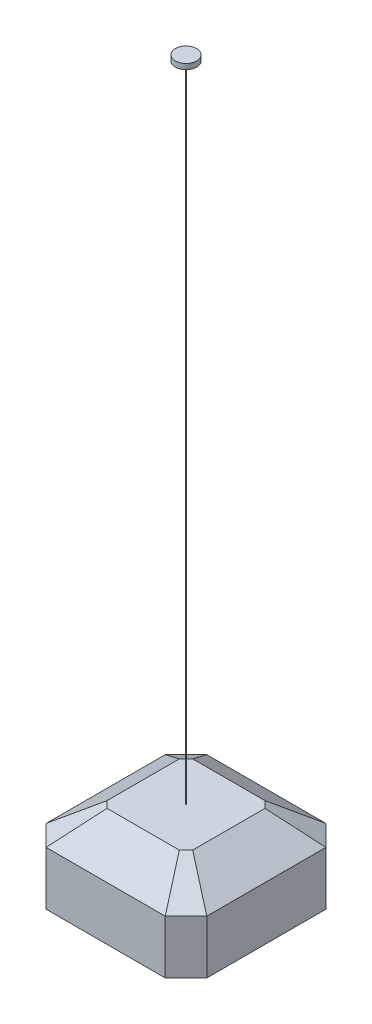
SolidWorks part; units mm, degrees
ref_plane "Alzado" through (0, 0, 0) normal (0, 0, 1) x (1, 0, 0)
ref_plane "Planta" through (0, 0, 0) normal (0, 1, 0) x (1, 0, 0)
ref_plane "Vista lateral" through (0, 0, 0) normal (1, 0, 0) x (0, 0, -1)
sketch "Croquis1" plane through (0, 0, 0) normal (0, 1, 0) x (1, 0, 0)
  line L9 (-160, 135) -> (-160, -135)
  line L10 (-135, -160) -> (135, -160)
  line L11 (160, -135) -> (160, 135)
  line L12 (135, 160) -> (-135, 160)
  line L13 (-135, 160) -> (-160, 135)
  line L14 (160, 135) -> (135, 160)
  line L15 (135, -160) -> (160, -135)
  line L16 (-160, -135) -> (-135, -160)
  circle A0 centre (0, 0) radius 160 construction
  point P2 (-160, 160)
  point P3 (-160, -160)
  point P4 (160, -160)
  point P5 (160, 160)
  point P10 (-160, 160)
  dimension "D1" = 320
ref_plane "Plano1" through (0, 100, 0) normal (0, 1, 0) x (1, 0, 0)
ref_plane "Plano2" through (0, 300, 0) normal (0, 1, 0) x (1, 0, 0)
ref_plane "Plano3" through (0, 400, 0) normal (0, 1, 0) x (1, 0, 0)
sketch "Croquis2" plane through (0, 100, 0) normal (0, 1, 0) x (1, 0, 0)
  line L24 (222.4438, 300) -> (-222.4438, 300)
  line L25 (-222.4438, 300) -> (-300, 222.4438)
  line L26 (-300, 222.4438) -> (-300, -222.4438)
  line L27 (-300, -222.4438) -> (-222.4438, -300)
  line L28 (-222.4438, -300) -> (222.4438, -300)
  line L29 (222.4438, -300) -> (300, -222.4438)
  line L30 (300, -222.4438) -> (300, 222.4438)
  line L31 (300, 222.4438) -> (222.4438, 300)
  dimension "D2" = 600
  dimension "D1" = 600
sketch "Croquis3" plane through (0, 300, 0) normal (0, 1, 0) x (1, 0, 0)
  line L16 (222.4438, 300) -> (-222.4438, 300)
  line L17 (-222.4438, 300) -> (-300, 222.4438)
  line L18 (-300, 222.4438) -> (-300, -222.4438)
  line L19 (-300, -222.4438) -> (-222.4438, -300)
  line L20 (-222.4438, -300) -> (222.4438, -300)
  line L21 (222.4438, -300) -> (300, -222.4438)
  line L22 (300, -222.4438) -> (300, 222.4438)
  line L23 (300, 222.4438) -> (222.4438, 300)
  line L24 (222.4438, 300) -> (-222.4438, 300)
  line L25 (-222.4438, 300) -> (-300, 222.4438)
  line L26 (-300, 222.4438) -> (-300, -222.4438)
  line L27 (-300, -222.4438) -> (-222.4438, -300)
  line L28 (-222.4438, -300) -> (222.4438, -300)
  line L29 (222.4438, -300) -> (300, -222.4438)
  line L30 (300, -222.4438) -> (300, 222.4438)
  line L31 (300, 222.4438) -> (222.4438, 300)
  dimension "D1" = 0
sketch "Croquis4" plane through (0, 400, 0) normal (0, 1, 0) x (1, 0, 0)
  line L16 (135, 160) -> (-135, 160)
  line L17 (-135, 160) -> (-160, 135)
  line L18 (-160, 135) -> (-160, -135)
  line L19 (-160, -135) -> (-135, -160)
  line L20 (-135, -160) -> (135, -160)
  line L21 (135, -160) -> (160, -135)
  line L22 (160, -135) -> (160, 135)
  line L23 (160, 135) -> (135, 160)
  line L24 (135, 160) -> (-135, 160)
  line L25 (-135, 160) -> (-160, 135)
  line L26 (-160, 135) -> (-160, -135)
  line L27 (-160, -135) -> (-135, -160)
  line L28 (-135, -160) -> (135, -160)
  line L29 (135, -160) -> (160, -135)
  line L30 (160, -135) -> (160, 135)
  line L31 (160, 135) -> (135, 160)
  dimension "D1" = 0
loft "Recubrir1" add profiles "Croquis1", "Croquis2"
loft "Recubrir2" add profiles "Croquis3", "Croquis4"
sketch "Croquis5" plane through (0, 300, 0) normal (0, -1, 0) x (1, 0, 0)
  line L16 (222.4438, -300) -> (300, -222.4438)
  line L17 (300, -222.4438) -> (300, 222.4438)
  line L18 (300, 222.4438) -> (222.4438, 300)
  line L19 (222.4438, 300) -> (-222.4438, 300)
  line L20 (-222.4438, 300) -> (-300, 222.4438)
  line L21 (-300, 222.4438) -> (-300, -222.4438)
  line L22 (-300, -222.4438) -> (-222.4438, -300)
  line L23 (-222.4438, -300) -> (222.4438, -300)
  line L24 (222.4438, -300) -> (300, -222.4438)
  line L25 (300, -222.4438) -> (300, 222.4438)
  line L26 (300, 222.4438) -> (222.4438, 300)
  line L27 (222.4438, 300) -> (-222.4438, 300)
  line L28 (-222.4438, 300) -> (-300, 222.4438)
  line L29 (-300, 222.4438) -> (-300, -222.4438)
  line L30 (-300, -222.4438) -> (-222.4438, -300)
  line L31 (-222.4438, -300) -> (222.4438, -300)
  dimension "D1" = 0
sketch "Croquis6" plane through (0, 100, 0) normal (0, 1, 0) x (1, 0, 0)
  line L16 (300, 222.4438) -> (222.4438, 300)
  line L17 (222.4438, 300) -> (-222.4438, 300)
  line L18 (-222.4438, 300) -> (-300, 222.4438)
  line L19 (-300, 222.4438) -> (-300, -222.4438)
  line L20 (-300, -222.4438) -> (-222.4438, -300)
  line L21 (-222.4438, -300) -> (222.4438, -300)
  line L22 (222.4438, -300) -> (300, -222.4438)
  line L23 (300, -222.4438) -> (300, 222.4438)
  line L24 (300, 222.4438) -> (222.4438, 300)
  line L25 (222.4438, 300) -> (-222.4438, 300)
  line L26 (-222.4438, 300) -> (-300, 222.4438)
  line L27 (-300, 222.4438) -> (-300, -222.4438)
  line L28 (-300, -222.4438) -> (-222.4438, -300)
  line L29 (-222.4438, -300) -> (222.4438, -300)
  line L30 (222.4438, -300) -> (300, -222.4438)
  line L31 (300, -222.4438) -> (300, 222.4438)
  dimension "D1" = 0
loft "Recubrir3" add profiles "Croquis6", "Croquis5"
sketch "Croquis7" plane through (0, 0, 0) normal (0, 0, 1) x (1, 0, 0)
  line L0 (0, 400) -> (0, 2800)
  line L1 (-135, 400) -> (135, 400) construction
  line L2 (0, 2800) -> (0, 2825)
  line L3 (0, 2825) -> (-40, 2825)
  line L4 (-40, 2825) -> (-40, 2805)
  line L5 (-40, 2805) -> (-5, 2805)
  line L6 (-5, 2805) -> (-5, 2800)
  line L8 (-5, 2800) -> (-1, 2800)
  line L9 (-1, 2800) -> (-1, 400)
  line L10 (-1, 400) -> (0, 400)
  dimension "D2" = 40
  dimension "D1" = 2400
  dimension "D3" = 35
revolve "Revolución1" add sketch "Croquis7" angle 360 about L0
